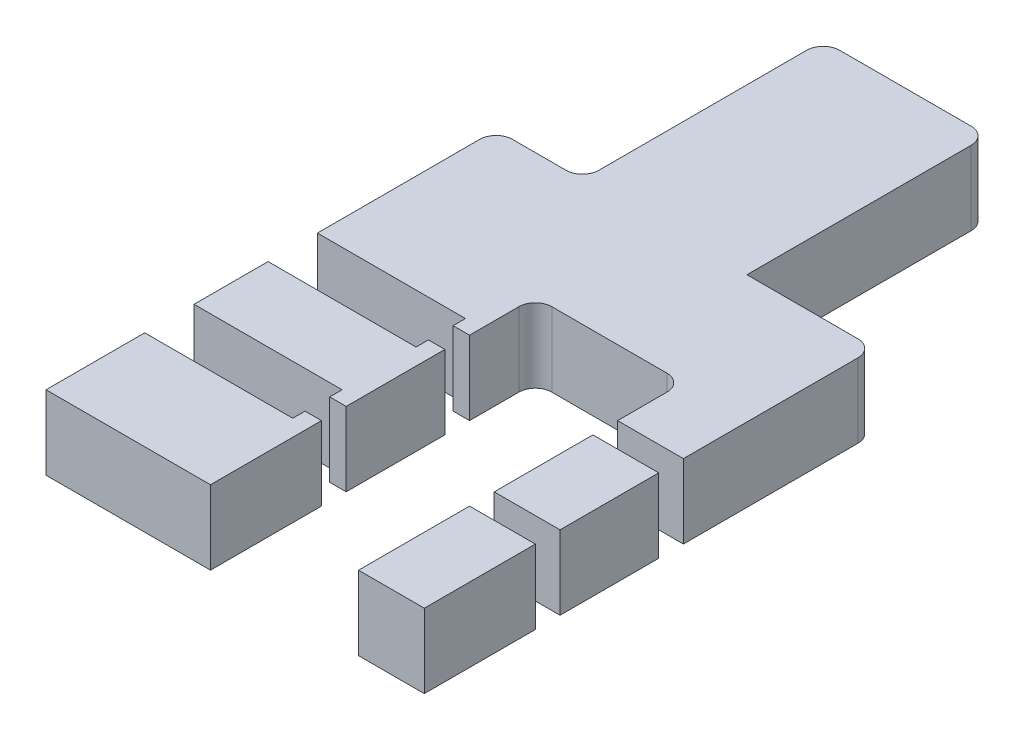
SolidWorks part; units mm, degrees
ref_plane "Front Plane" through (0, 0, 0) normal (0, 0, 1) x (1, 0, 0)
ref_plane "Top Plane" through (0, 0, 0) normal (0, 1, 0) x (1, 0, 0)
ref_plane "Right Plane" through (0, 0, 0) normal (1, 0, 0) x (0, 0, -1)
sketch "Sketch1" plane through (0, 0, 0) normal (0, 1, 0) x (1, 0, 0)
  line L0 (0, 0) -> (0, 51.3145) construction
  line L1 (-22.8872, -39.5) -> (22.8872, -39.5) construction
  line L2 (-13, 55.5) -> (-4, 55.5) construction
  line L3 (-9, 0) -> (9, 0) construction
  line L4 (-9, 0) -> (-9, -39.5)
  line L5 (-9, -39.5) -> (-29, -39.5)
  line L6 (-1.9414, 61.5) -> (11.2869, 61.5) construction
  line L7 (-1.9414, 55.5) -> (40.0184, 55.5) construction
  line L8 (-48.7363, 0) -> (21.3784, 0) construction
  line L9 (-29, -39.5) -> (-29, 15.2276)
  line L10 (-29, 15.2276) -> (-18.5, 15.2276)
  line L11 (-18.5, 15.2276) -> (-18.5, 44.5)
  line L12 (-18.5, 61.5) -> (1.5, 61.5) construction
  line L13 (9, 0) -> (9, -39.5)
  line L14 (9, -39.5) -> (17, -39.5)
  line L15 (17, -39.5) -> (17, 15.2276)
  line L16 (-18.5, 44.5) -> (1.5, 44.5)
  line L17 (1.5, 61.5) -> (1.5, 55.5) construction
  line L18 (-9, 0) -> (9, 0)
  line L19 (-19, -39.5) -> (-19, -19.5756) construction
  line L20 (1.5, 15.2276) -> (17, 15.2276)
  line L21 (1.5, 44.5) -> (1.5, 15.2276)
  line L22 (-18.5, 55.5) -> (-18.5, 61.5) construction
  circle A0 centre (-13, 55.5) radius 1 construction
  circle A1 centre (-4, 55.5) radius 1 construction
  point P0 (0, 0)
  point P20 (0, 0)
  point P21 (-13, 55.5)
  point P33 (0, 61.5)
  dimension "D2" = 4
  dimension "D8" = 8
  dimension "D9" = 2
  dimension "D1" = 95
  dimension "D3" = 9
  dimension "D4" = 18
  dimension "D5" = 39.5
  dimension "D6" = 20
  dimension "D7" = 6
  dimension "D10" = 5.5
  dimension "D11" = 5.5
  dimension "D12" = 17
extrude "Boss-Extrude1" add sketch "Sketch1" along normal blind 9
fillet "Fillet3" radius 2 7 edges at (-29, 4.5, -15.2276) (-18.5, 4.5, -15.2276) (9, 4.5, 0) (-9, 4.5, 0) (17, 4.5, -15.2276) (1.5, 4.5, -44.5) (-18.5, 4.5, -44.5)
sketch "Sketch2" plane through (0, 9, 0) normal (0, 1, 0) x (1, 0, 0)
  line L0 (-9, -39.5) -> (-9, -2) construction
  line L1 (-47.5606, -11) -> (29.5606, -11)
  line L2 (-47.5606, -11) -> (-47.5606, -8)
  line L3 (-47.5606, -8) -> (29.5606, -8)
  line L4 (29.5606, -11) -> (29.5606, -8)
  line L5 (-47.5606, -11) -> (29.5606, -8) construction
  line L6 (-47.5606, -8) -> (29.5606, -11) construction
  line L7 (-29, -39.5) -> (-9, -39.5) construction
  line L8 (-50.4891, -26) -> (32.4891, -26)
  line L9 (-50.4891, -26) -> (-50.4891, -23)
  line L10 (-50.4891, -23) -> (32.4891, -23)
  line L11 (32.4891, -26) -> (32.4891, -23)
  line L12 (-50.4891, -26) -> (32.4891, -23) construction
  line L13 (-50.4891, -23) -> (32.4891, -26) construction
  point P0 (-9, -9.5)
  point P7 (-9, -24.5)
  dimension "D1" = 30
  dimension "D2" = 15
  dimension "D3" = 3
  dimension "D4" = 3
extrude "Cut-Extrude1" cut sketch "Sketch2" against normal through all both and the other way through all
sketch "Sketch3" plane through (0, 9, 0) normal (0, 1, 0) x (1, 0, 0)
  line L0 (-9, -8) -> (-9, -11) construction
  line L1 (-9, -23) -> (-9, -26) construction
  line L2 (-9, -9.5) -> (5.0525, -9.5) construction
  line L3 (-9, -24.5) -> (-3.7497, -24.5) construction
  line L4 (-29, 13.2276) -> (-29, -8) construction
  line L5 (-29, -6.5) -> (-11, -6.5)
  line L6 (-29, -6.5) -> (-29, -12.5)
  line L7 (-29, -12.5) -> (-11, -12.5)
  line L8 (-11, -6.5) -> (-11, -12.5)
  line L9 (-29, -11) -> (-29, -23) construction
  line L10 (-29, -21.5) -> (-11, -21.5)
  line L11 (-29, -21.5) -> (-29, -27.5)
  line L12 (-29, -27.5) -> (-11, -27.5)
  line L13 (-11, -21.5) -> (-11, -27.5)
  line L14 (17, -23) -> (17, -11) construction
  point P18 (-11, -9.5)
  point P19 (-9, -9.5)
  point P26 (-11, -24.5)
  point P27 (-9, -24.5)
  dimension "D1" = 6
  dimension "D2" = 6
  dimension "D3" = 28
extrude "Cut-Extrude2" cut sketch "Sketch3" against normal through all
